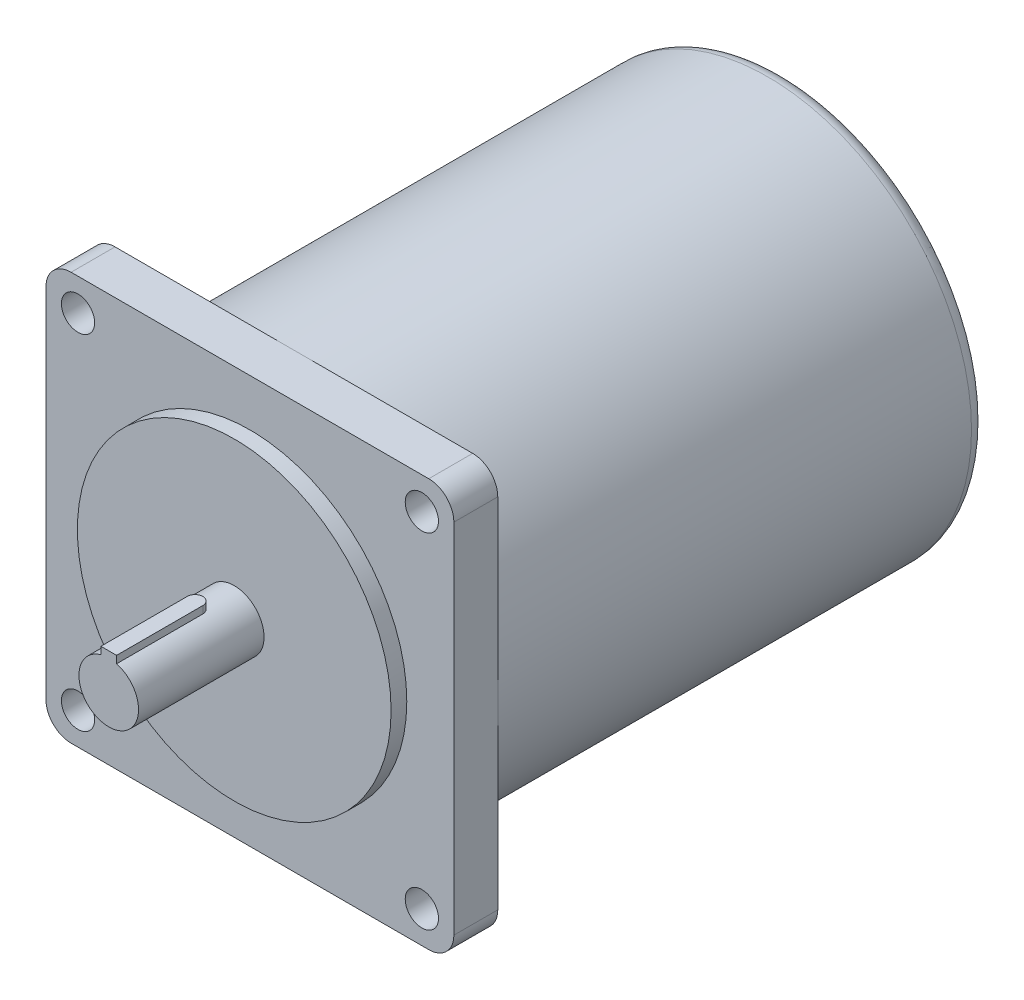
SolidWorks part; units mm, degrees
ref_plane "前视基准面" through (0, 0, 0) normal (0, 0, 1) x (1, 0, 0)
ref_plane "上视基准面" through (0, 0, 0) normal (0, 1, 0) x (1, 0, 0)
ref_plane "右视基准面" through (0, 0, 0) normal (1, 0, 0) x (0, 0, -1)
sketch "草图1" plane through (0, 0, 0) normal (0, 0, 1) x (1, 0, 0)
  circle A0 centre (0, 0) radius 50
extrude "凸台-拉伸1" add sketch "草图1" against normal blind 5
sketch "草图2" plane through (0, 0, 0) normal (0, 0, 1) x (1, 0, 0)
  circle A0 centre (0, 0) radius 9.5
extrude "凸台-拉伸2" add sketch "草图2" along normal blind 40
sketch "草图3" plane through (0, 0, 0) normal (0, 1, 0) x (1, 0, 0)
  line L1 (-9.5, -40) -> (9.5, -40) construction
  line L2 (-2.5, -12.5) -> (-2.5, -40)
  line L3 (-2.5, -40) -> (2.5, -40)
  line L4 (2.5, -40) -> (2.5, -12.5)
  arc A0 (2.5, -12.5) -> (-2.5, -12.5) centre (0, -12.5) ccw
extrude "凸台-拉伸3" add sketch "草图3" along normal blind 11.5
sketch "草图4" plane through (0, 0, -5) normal (0, 0, -1) x (-1, 0, 0)
  line L1 (0, 65) -> (57, 65)
  line L2 (65, 57) -> (65, -57)
  line L3 (57, -65) -> (-57, -65)
  line L4 (-65, -57) -> (-65, 57)
  line L5 (-57, 65) -> (0, 65)
  arc A0 (-57, -65) -> (-65, -57) centre (-57, -57) cw
  arc A1 (65, -57) -> (57, -65) centre (57, -57) cw
  arc A2 (57, 65) -> (65, 57) centre (57, 57) cw
  arc A3 (-65, 57) -> (-57, 65) centre (-57, 57) cw
  circle A4 centre (-54.8, 54.8) radius 5.3
  circle A5 centre (54.8, 54.8) radius 5.3
  circle A6 centre (54.8, -54.8) radius 5.3
  circle A7 centre (-54.8, -54.8) radius 5.3
  dimension "D1" = 8
extrude "凸台-拉伸4" add sketch "草图4" along normal blind 14
sketch "草图6" plane through (0, 0, -19) normal (0, 0, -1) x (-1, 0, 0)
  circle A0 centre (0, 0) radius 65
extrude "凸台-拉伸5" add sketch "草图6" along normal blind 156
fillet "圆角1" radius 5 1 edges at (-65, 0, -175)
